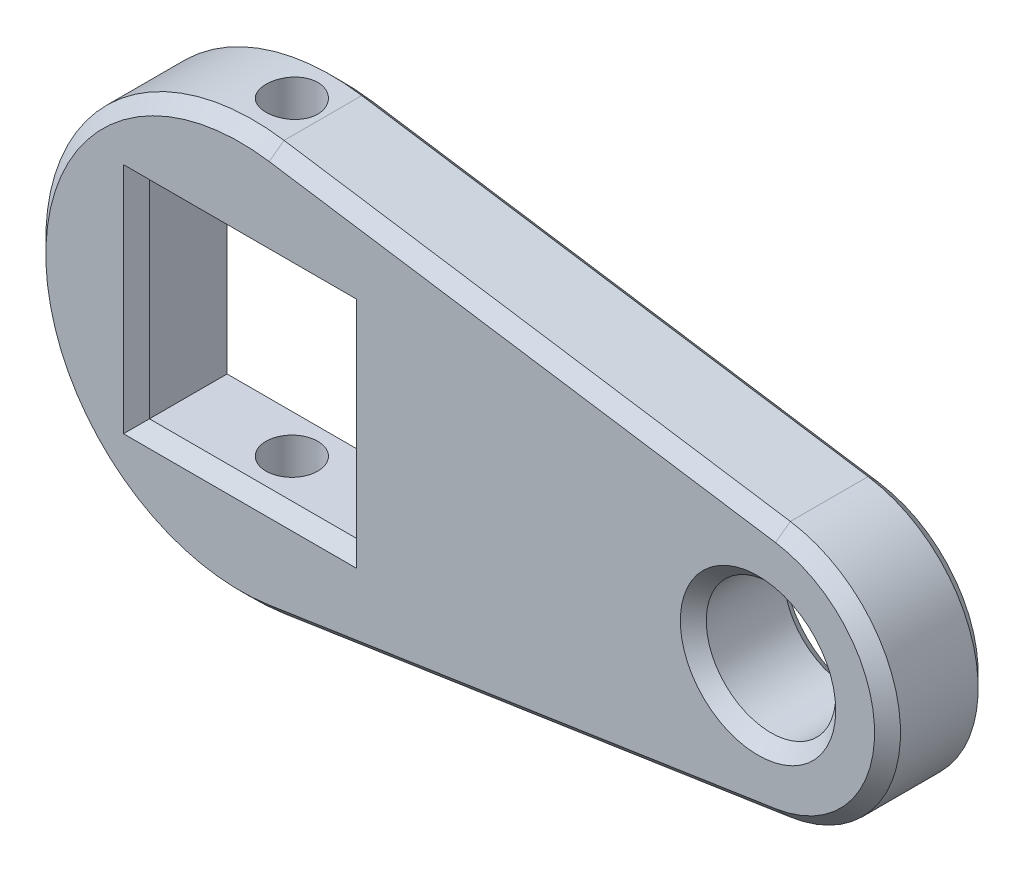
SolidWorks part; units mm, degrees
ref_plane "前视" through (0, 0, 0) normal (0, 0, 1) x (1, 0, 0)
ref_plane "上视" through (0, 0, 0) normal (0, 1, 0) x (1, 0, 0)
ref_plane "右视" through (0, 0, 0) normal (1, 0, 0) x (0, 0, -1)
sketch "草图1" plane through (0, 0, 0) normal (0, 0, 1) x (1, 0, 0)
  line L0 (0, 0) -> (41.6683, 0) construction
  line L1 (1.2, 7.9095) -> (20.75, 4.9434)
  line L2 (4, -4) -> (-4, -4)
  line L3 (4, -4) -> (4, 4)
  line L4 (4, 4) -> (-4, 4)
  line L5 (-4, -4) -> (-4, 4)
  line L6 (4, -4) -> (-4, 4) construction
  line L7 (4, 4) -> (-4, -4) construction
  line L8 (1.2, -7.9095) -> (20.75, -4.9434)
  arc A0 (1.2, 7.9095) -> (1.2, -7.9095) centre (0, 0) ccw
  circle A1 centre (20, 0) radius 2.5
  arc A2 (20.75, -4.9434) -> (20.75, 4.9434) centre (20, 0) ccw
  dimension "D1" = 8
  dimension "D2" = 8
  dimension "D3" = 20
  dimension "D4" = 5
  dimension "D5" = 5
extrude "凸台-拉伸1" add sketch "草图1" along normal mid plane 4
sketch "草图2" plane through (0, 0, 0) normal (0, 1, 0) x (1, 0, 0)
  circle A0 centre (0, 0) radius 1
  dimension "D1" = 2
extrude "切除-拉伸1" cut sketch "草图2" against normal mid plane 44
chamfer "倒角1" distance 0.5 angle 45 18 edges at (22.5, 0, -2) (0, 4, -2) (4, 0, -2) (0, -4, -2) (-4, 0, -2) (10.975, 6.4265, -2) (-8, 0, -2) (10.975, -6.4265, -2) (25, 0, -2) (22.5, 0, 2) (10.975, -6.4265, 2) (-8, 0, 2) (10.975, 6.4265, 2) (25, 0, 2) (4, 0, 2) (0, 4, 2) (-4, 0, 2) (0, -4, 2)
